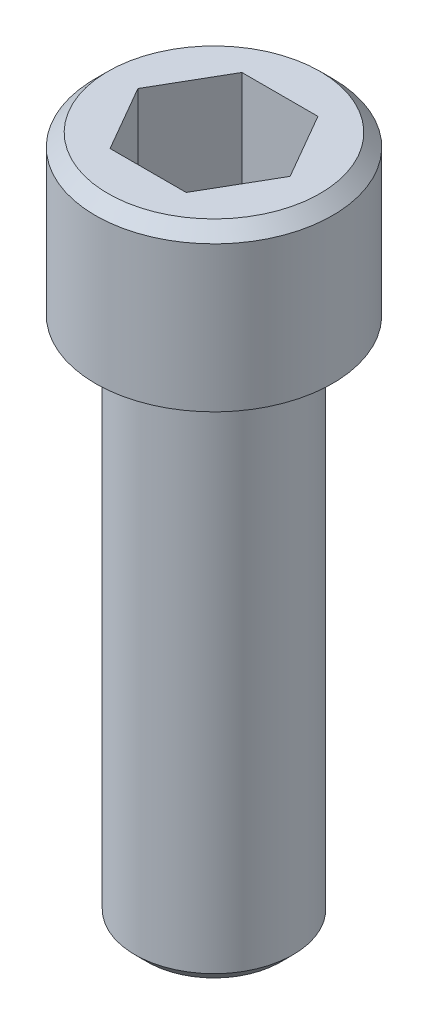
SolidWorks part; units mm, degrees
ref_plane "Plane1" through (0, 0, 0) normal (0, 0, 1) x (1, 0, 0)
ref_plane "Plane2" through (0, 0, 0) normal (0, 1, 0) x (1, 0, 0)
ref_plane "Plane3" through (0, 0, 0) normal (1, 0, 0) x (0, 0, -1)
sketch "Sketch1" plane through (0, 0, 0) normal (0, 0, 1) x (1, 0, 0)
  line L0 (0, 0) -> (0, 43.6223) construction
  line L1 (4.7625, 0) -> (7.1437, 0)
  line L2 (7.1437, 0) -> (7.1437, 9.525)
  line L3 (7.1437, 9.525) -> (0, 9.525)
  line L4 (0, 9.525) -> (0, -31.75)
  line L5 (0, -31.75) -> (4.7625, -31.75)
  line L6 (4.7625, -31.75) -> (4.7625, 0)
  line L7 (50, 0) -> (-50, 0) construction
  dimension "D1" = 14.2875
  dimension "D2" = 9.525
  dimension "D3" = 9.525
  dimension "D4" = 31.75
revolve "Base-Revolve" add sketch "Sketch1" angle 360 about L0
sketch "Sketch2" plane through (0, 9.525, 0) normal (0, 1, 0) x (-1, 0, 0)
  line L0 (2.2914, -3.9688) -> (-2.2914, -3.9688)
  line L1 (-4.5827, 0) -> (-2.2914, -3.9688)
  line L2 (0, 0) -> (0, -3.9688) construction
  line L3 (0, 0) -> (-4.5827, 0) construction
  line L4 (4.5827, 0) -> (2.2914, -3.9688)
  line L5 (4.5827, 0) -> (2.2914, 3.9688)
  line L6 (-4.5827, 0) -> (-2.2914, 3.9688)
  line L7 (2.2914, 3.9688) -> (-2.2914, 3.9688)
  circle A0 centre (0, 0) radius 3.9688 construction
  point P12 (0, -3.9688)
  point P14 (0, 3.9688)
  dimension "D2" = 7.9375
extrude "Cut-Extrude1" cut sketch "Sketch2" against normal blind 6.35
chamfer "Chamfer1" distance 0.762 angle 45 1 edges at (0, 9.525, -7.1437)
chamfer "Chamfer2" distance 0.762 angle 45 1 edges at (0, -31.75, -4.7625)
